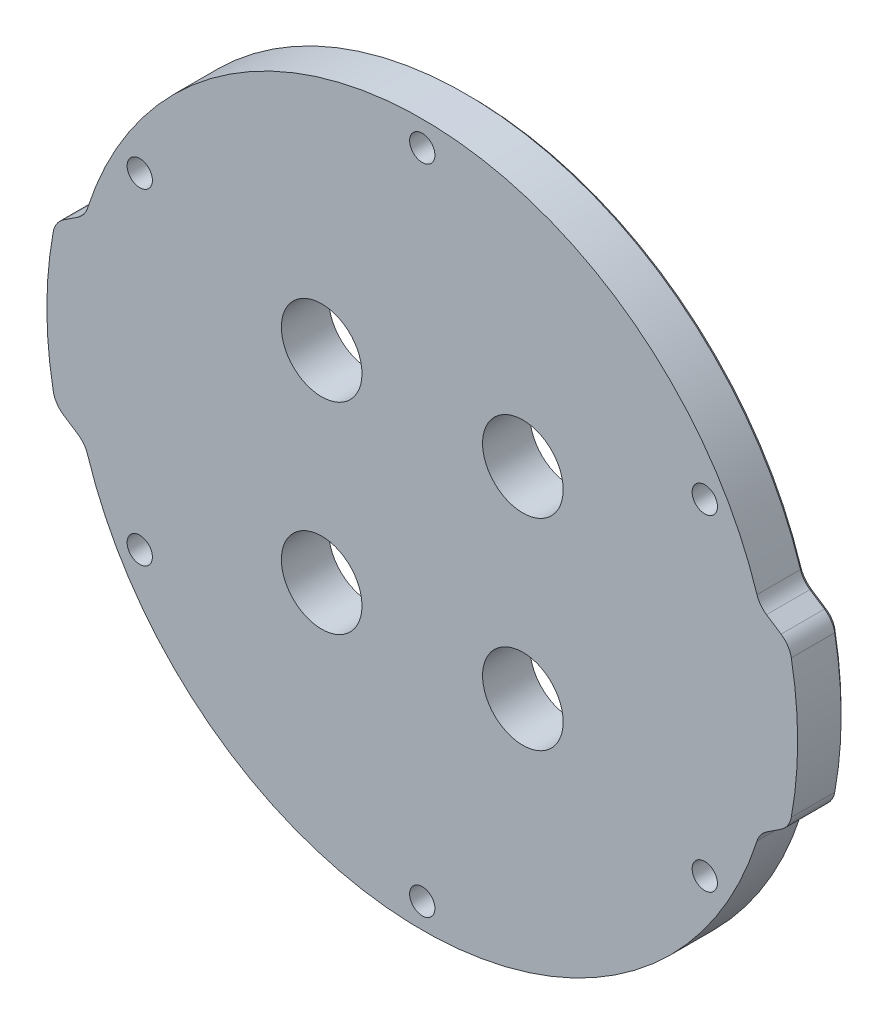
SolidWorks part; units mm, degrees
other "<WTE3-M-END-CAP-4-HOLE-R1>-<Chamfer1>"
ref_plane "Front Plane" through (0, 0, 0) normal (0, 0, 1) x (1, 0, 0)
ref_plane "Top Plane" through (0, 0, 0) normal (0, 1, 0) x (1, 0, 0)
ref_plane "Right Plane" through (0, 0, 0) normal (1, 0, 0) x (0, 0, -1)
inserted part "WTE3-M-END-CAP-4-HOLE-R1"
